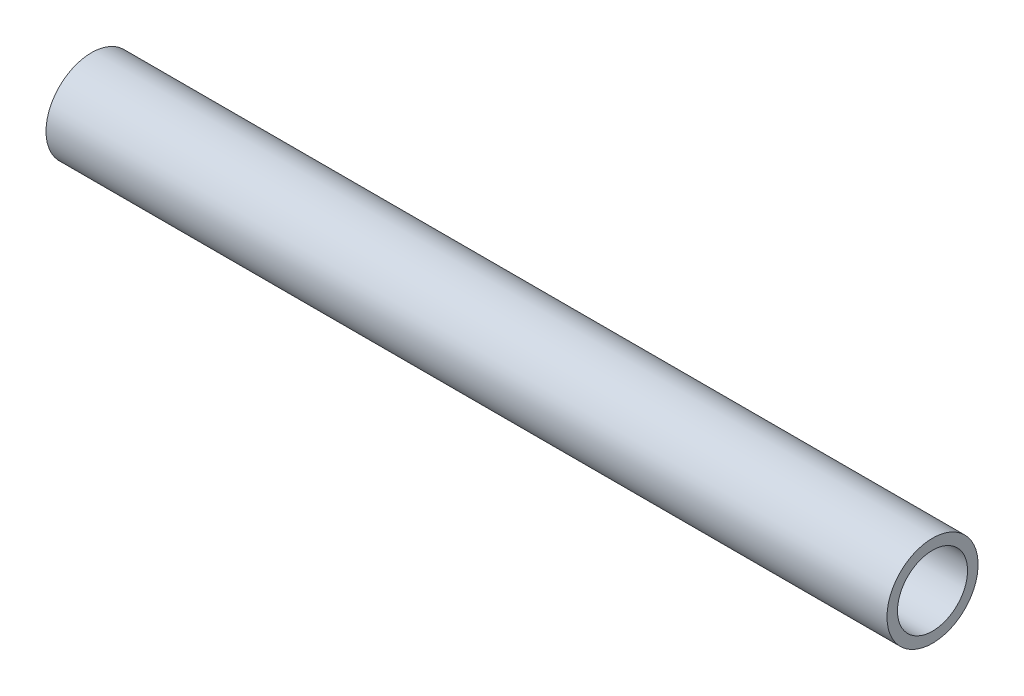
SolidWorks part; units mm, degrees
ref_plane "Front" through (0, 0, 0) normal (0, 0, 1) x (1, 0, 0)
ref_plane "Top" through (0, 0, 0) normal (0, 1, 0) x (1, 0, 0)
ref_plane "Right" through (0, 0, 0) normal (1, 0, 0) x (0, 0, -1)
sketch "Sketch1" plane through (0, 0, 0) normal (0, 0, 1) x (1, 0, 0)
  line L0 (0, 0) -> (304.8, 0)
  line L1 (9.9848, 0) -> (-9.9848, 0) construction
  dimension "D1" = 304.8
other "Structural Member1"
ref_plane "Plane1" through (0, 0, 0) normal (1, 0, 0) x (0, 0, -1)
sketch "Sketch11" plane through (0, 0, 0) normal (1, 0, 0) x (0, 0, -1)
  circle A0 centre (0, 0) radius 12.7
  circle A1 centre (0, 0) radius 16.51
  point P3 (0, 0)
  dimension "D1" = 33.02
  dimension "D2" = 25.4
